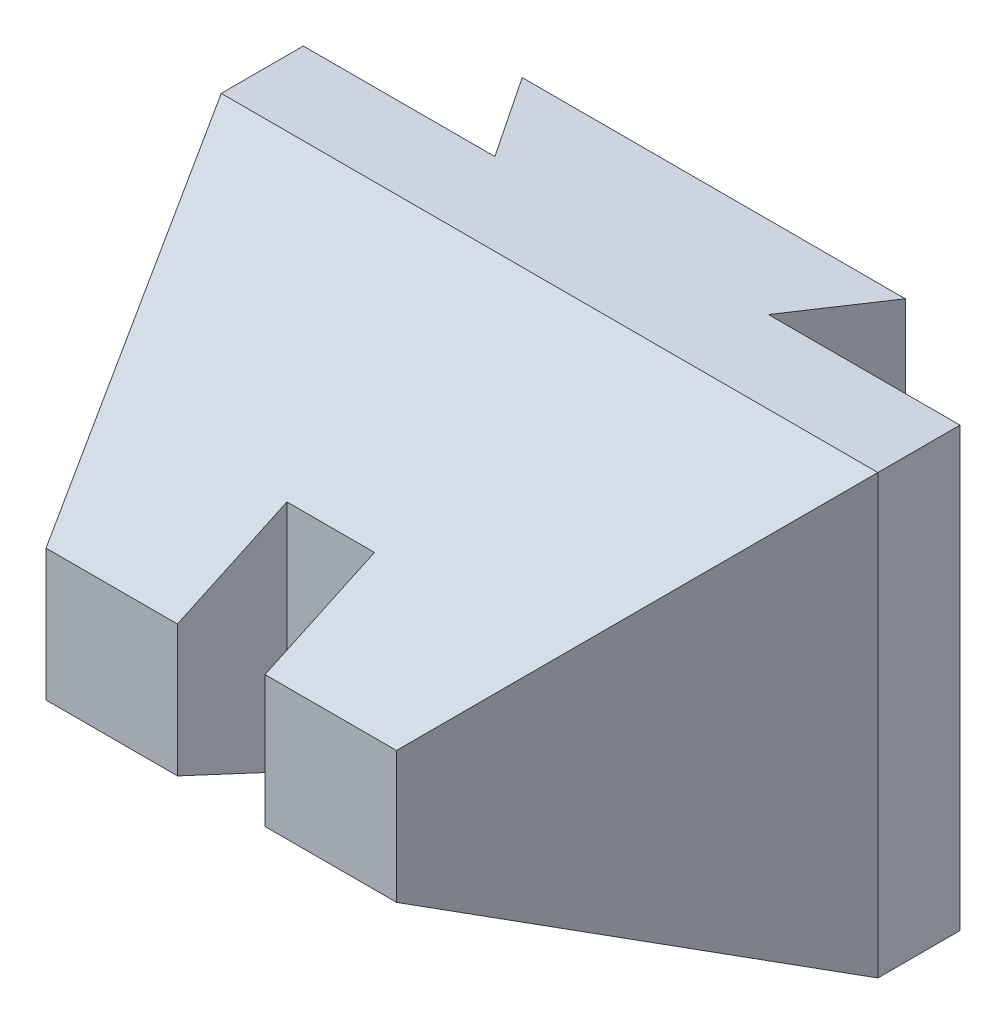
SolidWorks part; units mm, degrees
ref_plane "前视基准面" through (0, 0, 0) normal (0, 0, 1) x (1, 0, 0)
ref_plane "上视基准面" through (0, 0, 0) normal (0, 1, 0) x (1, 0, 0)
ref_plane "右视基准面" through (0, 0, 0) normal (1, 0, 0) x (0, 0, -1)
sketch "草图1" plane through (0, 0, 0) normal (0, 0, 1) x (1, 0, 0)
  line L0 (-100.3592, 0) -> (98.7534, 0) construction
  line L1 (0, -59.8141) -> (0, 60.2155) construction
  line L3 (-60, 40) -> (60, 40)
  line L4 (-60, 40) -> (-60, -40)
  line L5 (-60, -40) -> (60, -40)
  line L6 (60, 40) -> (60, -40)
  dimension "D1" = 120
  dimension "D2" = 80
extrude "拉伸1" add sketch "草图1" along normal blind 60 draft 25
sketch "草图2" plane through (0, 0, 0) normal (0, 0, -1) x (-1, 0, 0)
  line L4 (60, -40) -> (60, 40)
  line L5 (60, 40) -> (-60, 40)
  line L6 (-60, 40) -> (-60, -40)
  line L7 (-60, -40) -> (60, -40)
  line L8 (60, -40) -> (60, 40)
  line L9 (60, 40) -> (-60, 40)
  line L10 (-60, 40) -> (-60, -40)
  line L11 (-60, -40) -> (60, -40)
  dimension "D1" = 0
extrude "拉伸2" add sketch "草图2" along normal blind 30
sketch "草图3" plane through (0, 40, 0) normal (0, 1, 0) x (1, 0, 0)
  line L0 (-60, 15) -> (-25, 15)
  line L1 (-60, 30) -> (-60, 0) construction
  line L2 (-25, 15) -> (-35, 30)
  line L3 (60, 30) -> (-60, 30) construction
  line L4 (-35, 30) -> (-60, 30)
  line L5 (-60, 30) -> (-60, 15)
  dimension "D1" = 35
  dimension "D2" = 25
extrude "切除-拉伸1" cut sketch "草图3" against normal through all
mirror "镜向1" about plane through (0, 0, 0) normal (1, 0, 0) of "切除-拉伸1"
sketch "草图4" plane through (0, 0, 60) normal (0, 0, 1) x (1, 0, 0)
  line L0 (-27.7778, 0) -> (25.8621, 0) construction
  line L1 (0, -27.9693) -> (0, 27.3946) construction
  line L3 (-8, 25) -> (8, 25)
  line L4 (-8, 25) -> (-8, -25)
  line L5 (-8, -25) -> (8, -25)
  line L6 (8, 25) -> (8, -25)
  dimension "D1" = 16
  dimension "D2" = 50
extrude "切除-拉伸2" cut sketch "草图4" against normal blind 20
